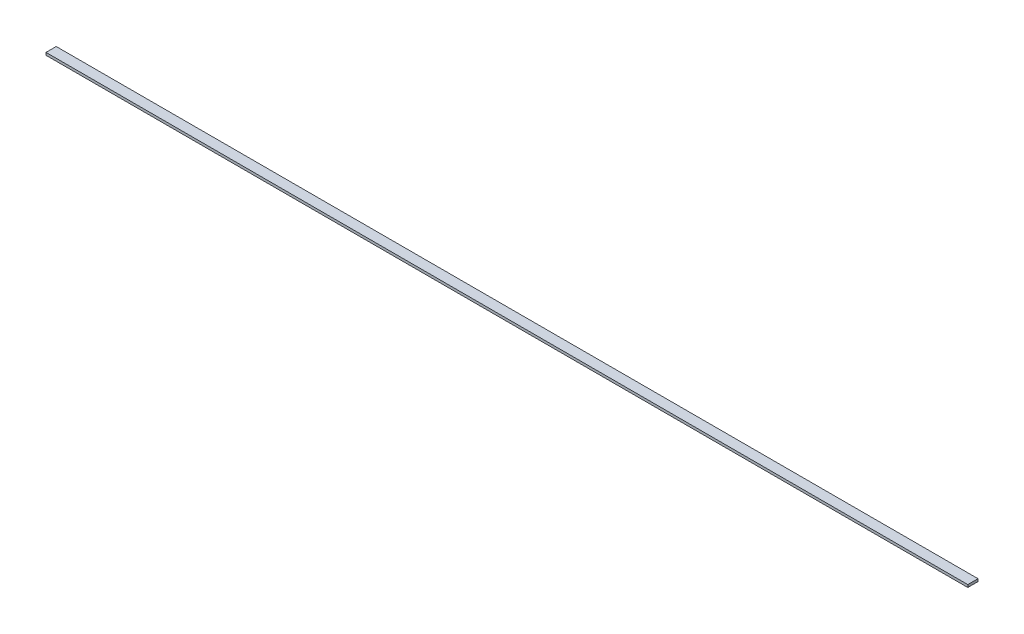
SolidWorks part; units mm, degrees
ref_plane "Front Plane" through (0, 0, 0) normal (0, 0, 1) x (1, 0, 0)
ref_plane "Top Plane" through (0, 0, 0) normal (0, 1, 0) x (1, 0, 0)
ref_plane "Right Plane" through (0, 0, 0) normal (1, 0, 0) x (0, 0, -1)
sketch "Sketch1" plane through (0, 0, 0) normal (0, 1, 0) x (1, 0, 0)
  line L1 (-1146.175, -12.7) -> (1146.175, -12.7)
  line L2 (-1146.175, -12.7) -> (-1146.175, 12.7)
  line L3 (-1146.175, 12.7) -> (1146.175, 12.7)
  line L4 (1146.175, -12.7) -> (1146.175, 12.7)
  line L5 (-1146.175, -12.7) -> (1146.175, 12.7) construction
  line L6 (-1146.175, 12.7) -> (1146.175, -12.7) construction
  point P0 (0, 0)
extrude "Boss-Extrude1" add sketch "Sketch1" along normal blind 6.35
equation "\"horizontal-component-length\"= \"railing-hypotenuse\" - \"railing-hypotenuse-horizontal-component-length-difference\""
equation "\"horizontal-component-width\"= 1in"
equation "\"D1@Sketch1\"=\"horizontal-component-length\""
equation "\"D2@Sketch1\"=\"horizontal-component-width\""
equation "\"material-thickness\"= .25in"
equation "\"D1@Boss-Extrude1\"=\"material-thickness\""
equation "\"railing-hypotenuse\"= 92in"
equation "\"railing-hypotenuse-horizontal-component-length-difference\"= 1.75in"
